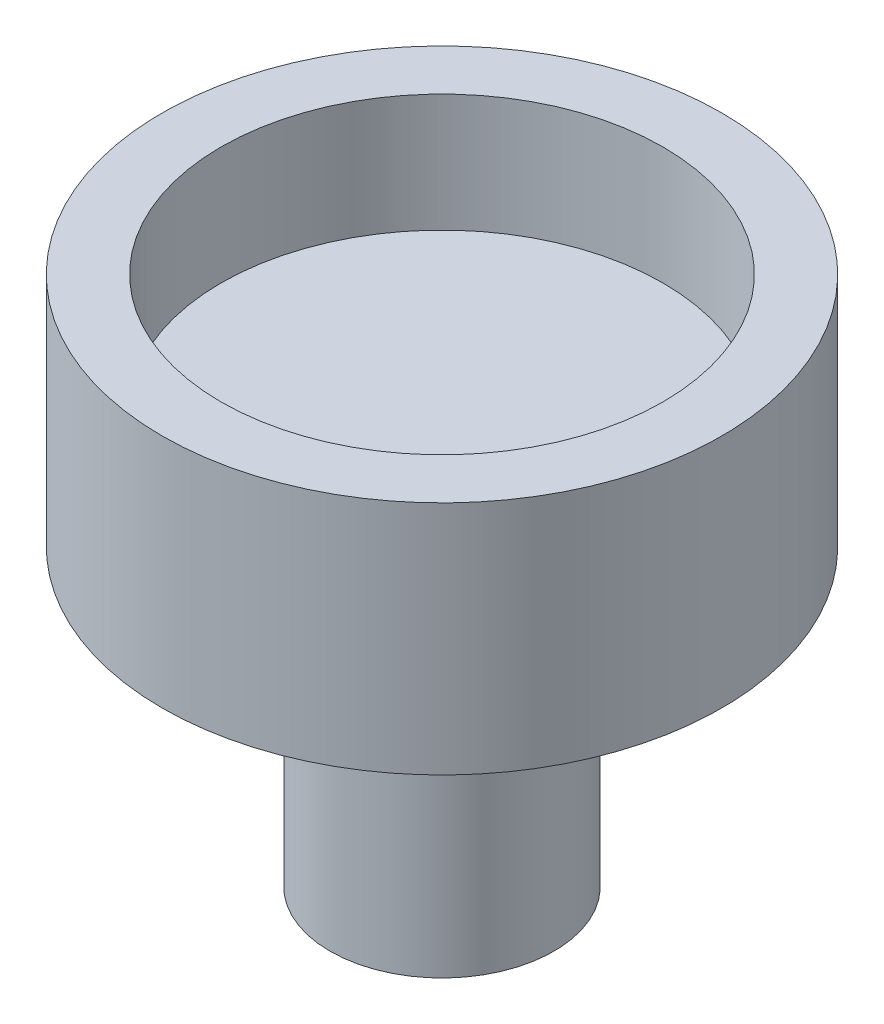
SolidWorks part; units mm, degrees
ref_plane "Front" through (0, 0, 0) normal (0, 0, 1) x (1, 0, 0)
ref_plane "Top" through (0, 0, 0) normal (0, 1, 0) x (1, 0, 0)
ref_plane "Right" through (0, 0, 0) normal (1, 0, 0) x (0, 0, -1)
sketch "Sketch1" plane through (0, 0, 0) normal (0, 0, 1) x (1, 0, 0)
  line L0 (-1.5875, 6.35) -> (-6.0325, 6.35)
  line L1 (-6.0325, 6.35) -> (-6.0325, 11.43)
  line L2 (-6.0325, 11.43) -> (-4.7625, 11.43)
  line L3 (-4.7625, 11.43) -> (-4.7625, 8.89)
  line L4 (-4.7625, 8.89) -> (0, 8.89)
  line L5 (0, 8.89) -> (0, 0)
  line L6 (0, 0) -> (0, 11.43) construction
  line L7 (-1.5875, 6.35) -> (-1.5875, 5.08)
  line L8 (-1.5875, 5.08) -> (-2.413, 5.08)
  line L9 (-2.413, 5.08) -> (-2.413, 0)
  line L10 (-2.413, 0) -> (0, 0)
  point P0 (0, 11.43)
  point P12 (0, 0)
  point P14 (0, -5.9507)
  dimension "D1" = 9.525
  dimension "D2" = 12.065
  dimension "D3" = 2.54
  dimension "D4" = 5.08
  dimension "D5" = 6.35
  dimension "D6" = 1.27
  dimension "D7" = 4.826
  dimension "D8" = 3.175
revolve "Revolve1" add sketch "Sketch1" angle 360 about L6
